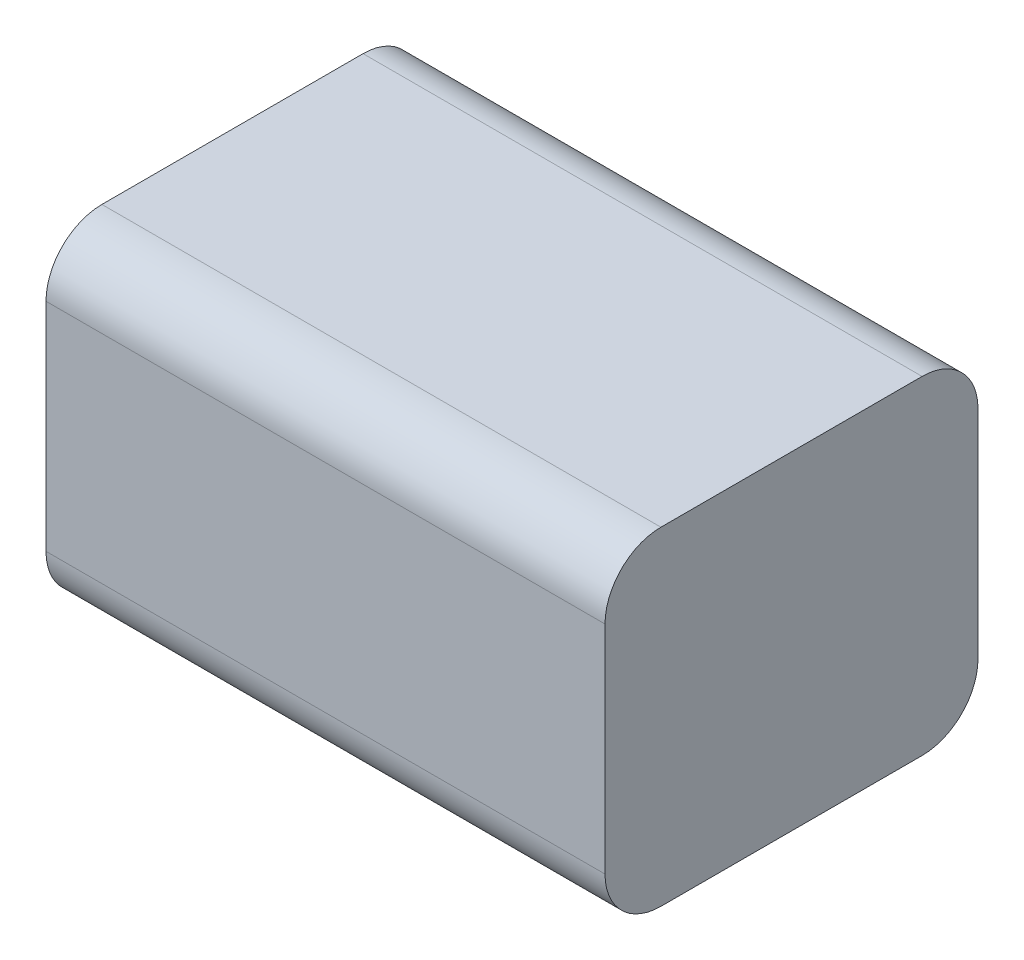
SolidWorks part; units mm, degrees
ref_plane "Front Plane" through (0, 0, 0) normal (0, 0, 1) x (1, 0, 0)
ref_plane "Top Plane" through (0, 0, 0) normal (0, 1, 0) x (1, 0, 0)
ref_plane "Right Plane" through (0, 0, 0) normal (1, 0, 0) x (0, 0, -1)
sketch "Sketch1" plane through (0, 0, 0) normal (1, 0, 0) x (0, 0, -1)
  line L1 (-16.68, -14.685) -> (16.68, -14.685)
  line L2 (-16.68, -14.685) -> (-16.68, 14.685)
  line L3 (-16.68, 14.685) -> (16.68, 14.685)
  line L4 (16.68, -14.685) -> (16.68, 14.685)
  line L5 (-16.68, -14.685) -> (16.68, 14.685) construction
  line L6 (-16.68, 14.685) -> (16.68, -14.685) construction
  point P0 (0, 0)
  dimension "D1" = 29.37
  dimension "D2" = 33.36
extrude "Boss-Extrude1" add sketch "Sketch1" along normal blind 50
fillet "Fillet1" radius 5 4 edges at (25, -14.685, 16.68) (25, -14.685, -16.68) (25, 14.685, 16.68) (25, 14.685, -16.68)
scale "Scale1" scale about centroid uniform scaling yes scale factor 0.7
